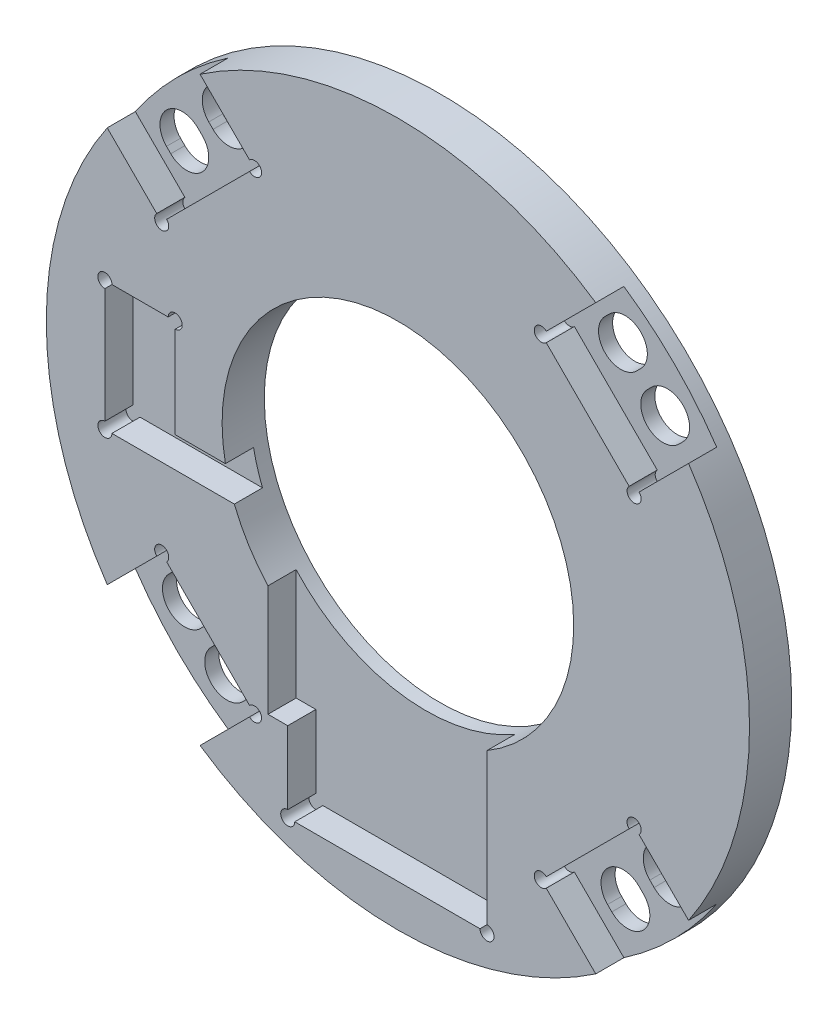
SolidWorks part; units mm, degrees
ref_plane "Front Plane" through (0, 0, 0) normal (0, 0, 1) x (1, 0, 0)
ref_plane "Top Plane" through (0, 0, 0) normal (0, 1, 0) x (1, 0, 0)
ref_plane "Right Plane" through (0, 0, 0) normal (1, 0, 0) x (0, 0, -1)
sketch "Sketch1" plane through (0, 0, 0) normal (0, 0, 1) x (1, 0, 0)
  line L0 (0, 61.2169) -> (0, 0) construction
  line L1 (0, 0) -> (94.0147, 0) construction
  circle A0 centre (0, 0) radius 75
  circle A1 centre (0, 0) radius 150
  dimension "D1" = 150
  dimension "D2" = 300
extrude "Boss-Extrude1" add sketch "Sketch1" along normal blind 18
ref_plane "Plane1" through (0, 0, 0) normal (-0.7071, 0.7071, 0) x (0.7071, 0.7071, 0)
ref_plane "Plane2" through (0, 0, 0) normal (0.7071, 0.7071, 0) x (0.7071, -0.7071, 0)
sketch "Sketch2" plane through (0, 0, 18) normal (0, 0, 1) x (1, 0, 0)
  line L0 (-123.7137, 84.8228) -> (-100.7627, 61.8718) construction
  line L1 (-100.7627, 61.8718) -> (-61.8718, 100.7627) construction
  line L2 (-61.8718, 100.7627) -> (-84.8228, 123.7137) construction
  line L3 (-124.0673, 84.4693) -> (-100.7627, 61.1647)
  line L4 (-100.7627, 61.1647) -> (-61.1647, 100.7627)
  line L5 (-61.1647, 100.7627) -> (-84.4693, 124.0673)
  circle A0 centre (0, 0) radius 150 construction
  dimension "D1" = 0.5
extrude "Cut-Extrude1" cut sketch "Sketch2" against normal blind 12 and the other way through all
sketch "Sketch3" plane through (0, 0, 6) normal (0, 0, 1) x (1, 0, 0)
  line L0 (-110.7208, 78.1939) -> (-108.8944, 76.3675)
  line L1 (-97.2857, 91.6289) -> (-95.4594, 89.8026)
  line L2 (-92.6896, 96.2251) -> (-90.8632, 94.3988)
  line L3 (-79.2545, 109.6601) -> (-77.4282, 107.8338)
  arc A0 (-90.8632, 94.3988) -> (-77.4282, 107.8338) centre (-84.1457, 101.1163) ccw
  arc A1 (-79.2545, 109.6601) -> (-92.6896, 96.2251) centre (-85.972, 102.9426) ccw
  arc A2 (-108.8944, 76.3675) -> (-95.4594, 89.8026) centre (-102.1769, 83.085) ccw
  arc A3 (-97.2857, 91.6289) -> (-110.7208, 78.1939) centre (-104.0033, 84.9114) ccw
extrude "Cut-Extrude2" cut sketch "Sketch3" against normal through all
pattern_circular "CirPattern1" count 4 over 360 about axis through (0, 0, 18) along (0, 0, -1) of "Cut-Extrude1"
pattern_circular "CirPattern2" count 4 over 360 about axis through (0, 0, 0) along (0, 0, 1) of "Cut-Extrude2"
sketch "Sketch4" plane through (0, 0, 18) normal (0, 0, 1) x (1, 0, 0)
  line L0 (-46, -131) -> (37, -131) construction
  line L1 (37, -131) -> (37, -49.9577) construction
  line L2 (-46, -131) -> (-46, -49.9577) construction
  line L3 (-46, -49.9577) -> (37, -49.9577) construction
  line L4 (-47, -132) -> (38, -132)
  line L5 (38, -132) -> (38, -48.9577)
  line L6 (-47, -48.9577) -> (38, -48.9577)
  line L7 (-47, -132) -> (-47, -48.9577)
  dimension "D1" = 1
extrude "Cut-Extrude3" cut sketch "Sketch4" against normal blind 12
sketch "Sketch5" plane through (0, 0, 18) normal (0, 0, 1) x (1, 0, 0)
  line L0 (-208.4999, 0) -> (-178.9091, 0) construction
  line L1 (-125.0047, 27.5) -> (-95.0047, 27.5)
  line L2 (-125.0047, 27.5) -> (-125.0047, -27.5)
  line L3 (-125.0047, -27.5) -> (-95.0047, -27.5)
  line L4 (-95.0047, 27.5) -> (-95.0047, -27.5)
  point P7 (-90.2342, -27.5)
  point P8 (-95.0047, -27.5)
  dimension "D1" = 30
  dimension "D2" = 55
extrude "Cut-Extrude4" cut sketch "Sketch5" against normal blind 12
sketch "Sketch6" plane through (0, 0, 18) normal (0, 0, 1) x (1, 0, 0)
  line L0 (-47, -97.9874) -> (-55.428, -97.9874)
  line L1 (-47, -58.4466) -> (-47, -132) construction
  line L2 (-55.428, -97.9874) -> (-55.428, -50.5247)
  line L3 (-55.428, -50.5247) -> (-47, -50.5247)
  line L4 (-47, -50.5247) -> (-47, -97.9874)
  line L5 (-95.0047, -27.5) -> (-95.0047, -14.4813)
  line L6 (-95.0047, -27.5) -> (-95.0047, 27.5) construction
  line L7 (-95.0047, -14.4813) -> (-58.6303, -14.4813)
  line L8 (-58.6303, -14.4813) -> (-58.6303, -27.5)
  line L9 (-58.6303, -27.5) -> (-95.0047, -27.5)
  arc A0 (38, -64.6607) -> (-47, -58.4466) centre (0, 0) ccw construction
extrude "Cut-Extrude5" cut sketch "Sketch6" against normal blind 12
sketch "Sketch7" plane through (0, 0, 18) normal (0, 0, 1) x (1, 0, 0)
  circle A0 centre (100.7627, 61.1647) radius 3
  circle A1 centre (61.1647, 100.7627) radius 3
  circle A2 centre (-61.1647, 100.7627) radius 3
  circle A3 centre (-100.7627, 61.1647) radius 3
  circle A4 centre (-125.0047, 27.5) radius 3
  circle A5 centre (-95.0047, 27.5) radius 3
  circle A6 centre (-125.0047, -27.5) radius 3
  circle A7 centre (-100.7627, -61.1647) radius 3
  circle A8 centre (-61.1647, -100.7627) radius 3
  circle A9 centre (-47, -132) radius 3
  circle A10 centre (38, -132) radius 3
  circle A11 centre (61.1647, -100.7627) radius 3
  circle A12 centre (100.7627, -61.1647) radius 3
  dimension "D1" = 6
extrude "Cut-Extrude6" cut sketch "Sketch7" against normal blind 12
